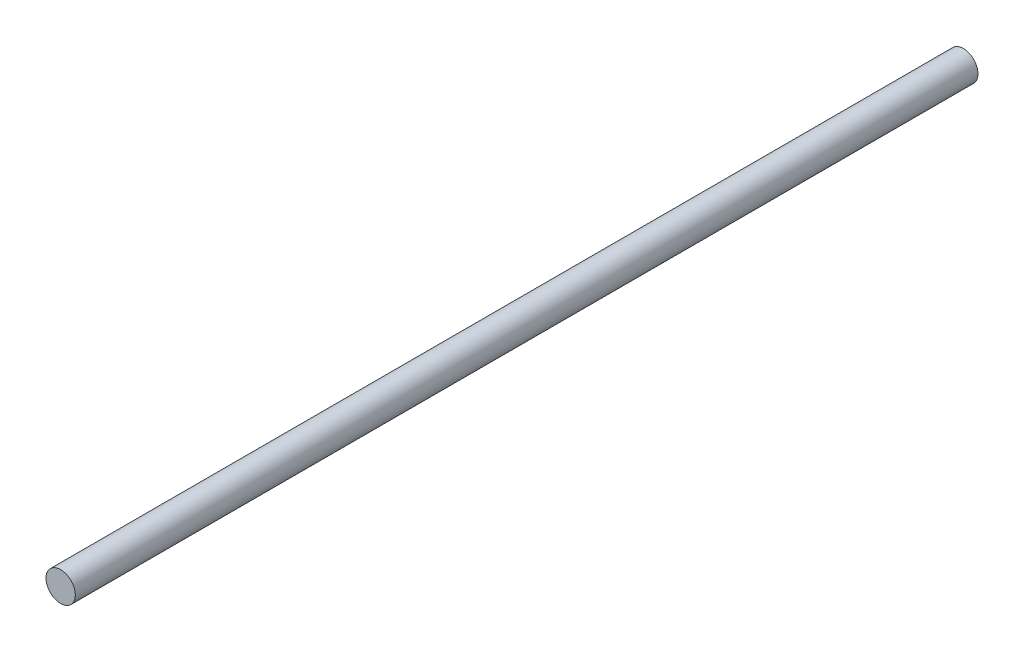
SolidWorks part; units mm, degrees
ref_plane "Front Plane" through (0, 0, 0) normal (0, 0, 1) x (1, 0, 0)
ref_plane "Top Plane" through (0, 0, 0) normal (0, 1, 0) x (1, 0, 0)
ref_plane "Right Plane" through (0, 0, 0) normal (1, 0, 0) x (0, 0, -1)
sketch "Sketch1" plane through (0, 0, 0) normal (0, 0, 1) x (1, 0, 0)
  circle A0 centre (0, 0) radius 31.7309
extrude "Boss-Extrude1" add sketch "Sketch1" along normal blind 1952.752
